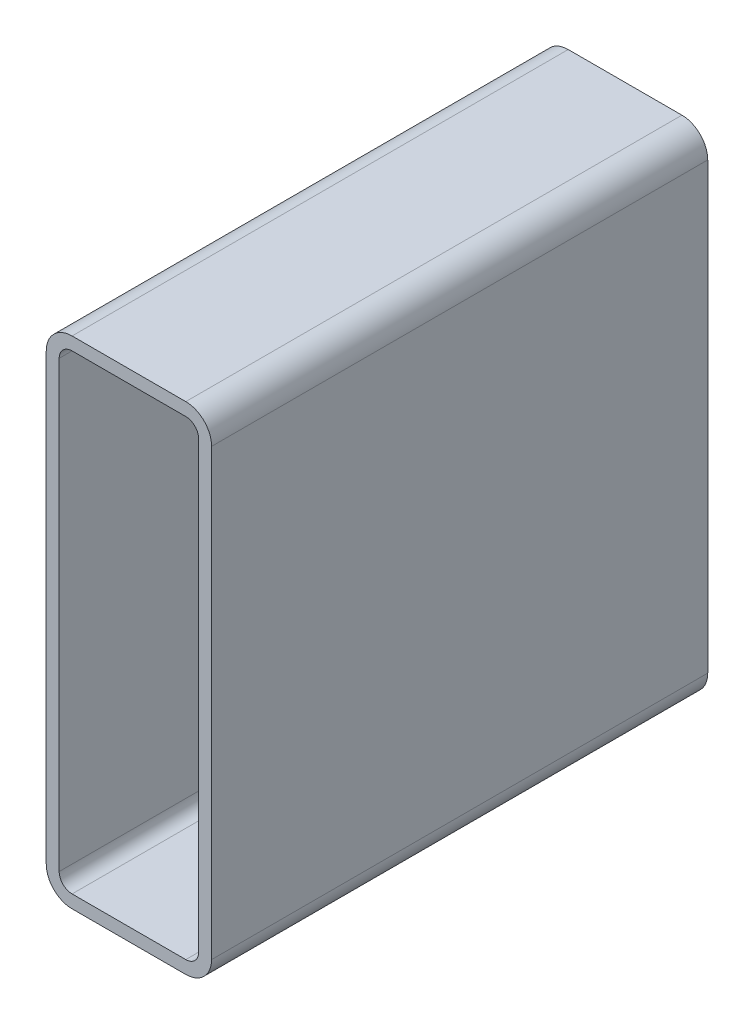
SolidWorks part; units mm, degrees
ref_plane "Front Plane" through (0, 0, 0) normal (0, 0, 1) x (1, 0, 0)
ref_plane "Top Plane" through (0, 0, 0) normal (0, 1, 0) x (1, 0, 0)
ref_plane "Right Plane" through (0, 0, 0) normal (1, 0, 0) x (0, 0, -1)
sketch "Sketch1" plane through (0, 0, 0) normal (0, 0, 1) x (1, 0, 0)
sketch_block_instance "HSS12x4x0.3125-1"
sketch_block "HSS12x4x0.3125"
extrude "Boss-Extrude1" add sketch "Sketch1" along normal blind 304.8
